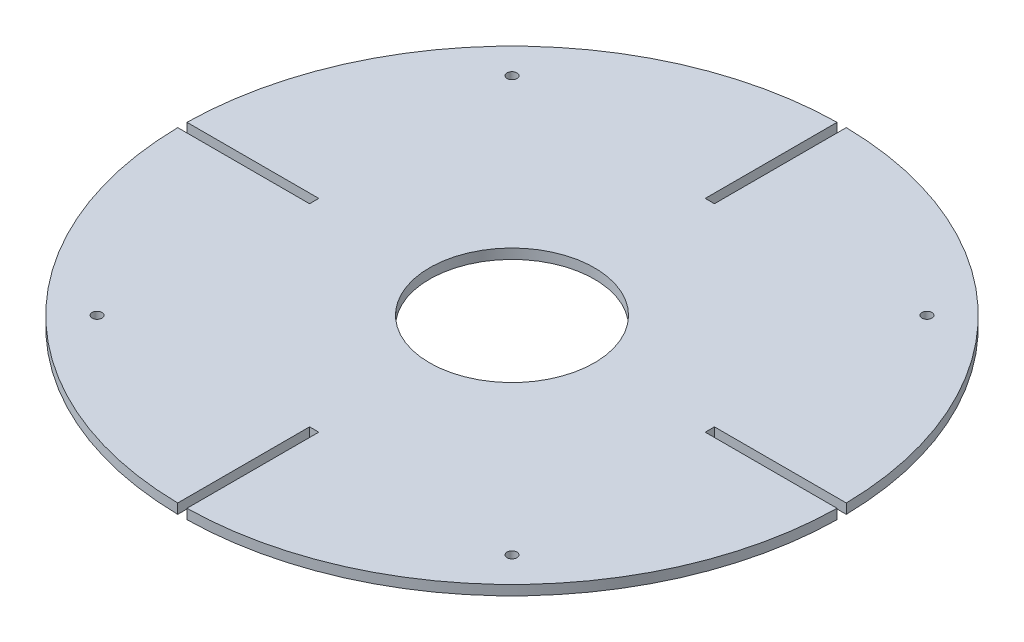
SolidWorks part; units mm, degrees
ref_plane "Front Plane" through (0, 0, 0) normal (0, 0, 1) x (1, 0, 0)
ref_plane "Top Plane" through (0, 0, 0) normal (0, 1, 0) x (1, 0, 0)
ref_plane "Right Plane" through (0, 0, 0) normal (1, 0, 0) x (0, 0, -1)
sketch "Sketch2" plane through (0, 0, 0) normal (0, 1, 0) x (1, 0, 0)
  line L7 (-132.9289, 99.95) -> (-90, 99.95) construction
  line L12 (-100.0046, 98.55) -> (-139.992, 98.55)
  line L14 (59.992, 98.55) -> (20.0046, 98.55)
  line L16 (-38.6, 159.9539) -> (-38.6, 199.942)
  line L24 (-41.4, 159.9539) -> (-41.4, 199.942)
  line L25 (-100.0046, 101.35) -> (-139.992, 101.35)
  line L37 (-100.0046, 99.95) -> (49, 99.95) construction
  line L38 (-40, 188.95) -> (-40, 10.95) construction
  line L42 (-41.4, 39.9494) -> (-41.4, -0.042)
  line L43 (-38.6, 39.9494) -> (-38.6, -0.042)
  line L49 (-115.0019, 101.4) -> (-140.0019, 101.4)
  line L50 (34.9973, 101.4) -> (59.9973, 101.4)
  line L51 (35.0019, 98.6) -> (60.0019, 98.6)
  line L58 (59.992, 101.35) -> (20.0046, 101.35)
  line L86 (-90, 99.95) -> (-40, 99.95) construction
  line L88 (-40, 149.95) -> (10, 99.95) construction
  line L90 (-40, 149.95) -> (-90, 99.95) construction
  line L94 (-40, 49.95) -> (-90, 99.95) construction
  line L96 (-40, 49.95) -> (10, 99.95) construction
  line L98 (23.9932, 35.9568) -> (-103.9932, 163.9432) construction
  line L101 (-100.0046, 101.35) -> (-100.0046, 98.55)
  line L104 (26.8683, 166.8183) -> (-103.9932, 35.9568) construction
  line L105 (20.0046, 98.55) -> (20.0046, 101.35)
  line L106 (-38.6, 159.9539) -> (-41.4, 159.9539)
  line L107 (-41.4, 39.9494) -> (-38.6, 39.9494)
  line L108 (-100.0013, 98.6) -> (-139.9889, 98.6)
  circle A0 centre (-40, 99.95) radius 25
  circle A1 centre (-40, 99.95) radius 89 construction
  circle A2 centre (-102.9325, 162.8825) radius 1.5
  circle A3 centre (22.9325, 162.8825) radius 1.5
  circle A4 centre (22.9325, 37.0175) radius 1.5
  circle A5 centre (-102.9325, 37.0175) radius 1.5
  arc A18 (-41.4, 199.942) -> (-139.992, 101.35) centre (-40, 99.95) ccw
  arc A19 (-139.992, 98.55) -> (-41.4, -0.042) centre (-40, 99.95) ccw
  arc A20 (59.992, 101.35) -> (-38.6, 199.942) centre (-40, 99.95) ccw
  arc A21 (-38.6, -0.042) -> (59.992, 98.55) centre (-40, 99.95) ccw
  point P1 (60, 200)
  point P3 (60, 0)
  point P5 (-140, 200)
  point P6 (-140, 0)
  point P21 (0, 0)
  point P44 (-40, 100)
  point P77 (-40, 100)
extrude "Boss-Extrude1" add sketch "Sketch2" along normal blind 3
equation "\"anchocaja\"= 8cm"
equation "\"altocaja\"= 12cm"
equation "\"altopieza\"= 20cm"
equation "\"anchopieza\"= 20cm"
equation "\"D1@Sketch2\"=\"altopieza\""
equation "\"grosor\" = .28cm"
equation "\"centrar\"= \"grosor\" / 2"
equation "\"g\" = 0.28cm"
equation "\"D8@Sketch2\"=\"centrar\""
equation "\"D14@Sketch2\"=\"centrar\""
equation "\"D15@Sketch2\"=\"centrar\""
equation "\"D16@Sketch2\"=\"centrar\""
equation "\"D5@Sketch2\"=\"centrar\""
equation "\"D6@Sketch2\"=\"centrar\""
equation "\"D7@Sketch2\"=\"centrar\""
